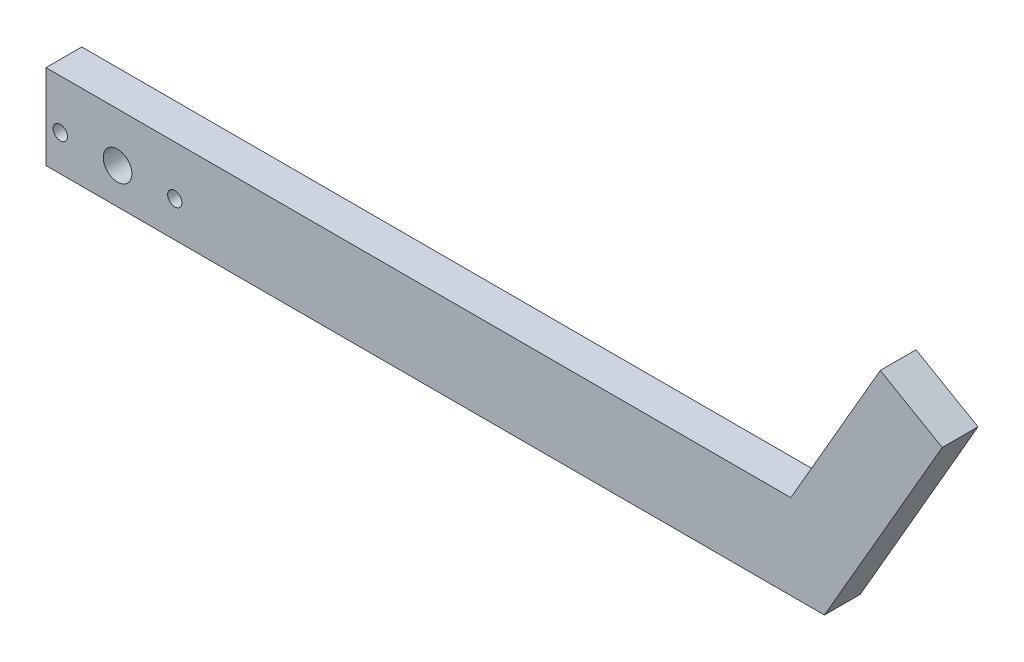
SolidWorks part; units mm, degrees
ref_plane "Front Plane" through (0, 0, 0) normal (0, 0, 1) x (1, 0, 0)
ref_plane "Top Plane" through (0, 0, 0) normal (0, 1, 0) x (1, 0, 0)
ref_plane "Right Plane" through (0, 0, 0) normal (1, 0, 0) x (0, 0, -1)
sketch "Sketch1" plane through (0, 0, 0) normal (0, 0, 1) x (1, 0, 0)
  line L0 (54.1095, 6.8643) -> (66.6095, 28.5149)
  line L1 (-50, 6.8643) -> (54.1095, 6.8643)
  line L2 (-50, 6.8643) -> (-50, -5)
  line L3 (-50, -5) -> (48.8776, -5)
  line L4 (66.6095, 28.5149) -> (75.2697, 23.5149)
  line L5 (75.2697, 23.5149) -> (58.8066, -5)
  line L7 (48.8776, -5) -> (58.8066, -5)
  dimension "D1" = 90
  dimension "D2" = 120
  dimension "D3" = 10
  dimension "D4" = 25
extrude "Boss-Extrude1" add sketch "Sketch1" along normal blind 5
sketch "Sketch2" plane through (0, 0, 5) normal (0, 0, 1) x (1, 0, 0)
  line L0 (-50, 6.8643) -> (-50, -5) construction
  circle A0 centre (-40, 0) radius 2
  circle A1 centre (-48, 0) radius 1
  circle A2 centre (-32, 0) radius 1
  dimension "D1" = 2
  dimension "D2" = 8
  dimension "D3" = 8
extrude "Cut-Extrude1" cut sketch "Sketch2" against normal blind 5
